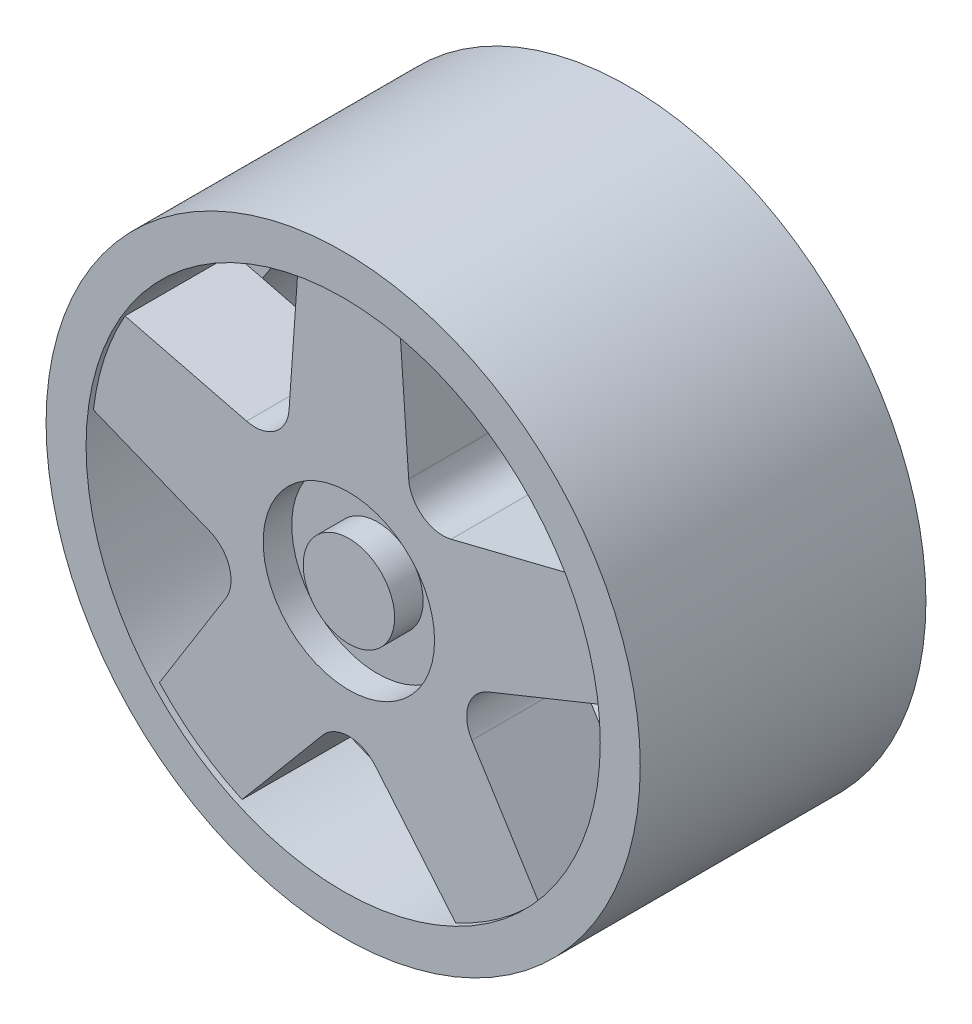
SolidWorks part; units mm, degrees
ref_plane "Front Plane" through (0, 0, 0) normal (0, 0, 1) x (1, 0, 0)
ref_plane "Top Plane" through (0, 0, 0) normal (0, 1, 0) x (1, 0, 0)
ref_plane "Right Plane" through (0, 0, 0) normal (1, 0, 0) x (0, 0, -1)
sketch "Sketch1" plane through (0, 0, 0) normal (0, 0, 1) x (1, 0, 0)
  circle A0 centre (-63.6221, -6.2963) radius 33
  dimension "D1" = 66
extrude "Boss-Extrude1" add sketch "Sketch1" along normal blind 25
fillet "Fillet1" radius 10 1 edges at (-30.6221, -6.2963, 25)
fillet "Fillet2" radius 3 1 edges at (-30.6221, -6.2963, 0)
sketch "Sketch2" plane through (0, 0, 0) normal (0, 0, -1) x (-1, 0, 0)
  spline S2 degree 3 number of poles 107 (83.6221, -6.2963) -> (83.6221, -6.2963)
  spline S3 degree 3 number of poles 107 (83.6221, -6.2963) -> (83.6221, -6.2963)
  dimension "D1" = 10
extrude "Cut-Extrude1" cut sketch "Sketch2" against normal blind 15
sketch "Sketch3" plane through (0, 0, 15) normal (0, 0, -1) x (-1, 0, 0)
  circle A0 centre (63.6221, -6.2963) radius 5
  dimension "D1" = 10
extrude "Boss-Extrude2" add sketch "Sketch3" along normal blind 20
sketch "Sketch6" plane through (0, 0, 25) normal (0, 0, 1) x (1, 0, 0)
  circle A0 centre (-63.6221, -6.2963) radius 7.5
  dimension "D1" = 15
extrude "Cut-Extrude2" cut sketch "Sketch6" against normal blind 3
sketch "Sketch7" plane through (0, 0, 22) normal (0, 0, 1) x (1, 0, 0)
  circle A0 centre (-63.6221, -6.2963) radius 4
  dimension "D1" = 8
extrude "Boss-Extrude3" add sketch "Sketch7" along normal blind 3
sketch "Sketch8" plane through (0, 0, 25) normal (0, 0, 1) x (1, 0, 0)
  circle A0 centre (-63.6221, -6.2963) radius 22.5
  dimension "D1" = 45
extrude "Cut-Extrude3" cut sketch "Sketch8" against normal blind 0.5
sketch "Sketch9" plane through (0, 0, 24.5) normal (0, 0, 1) x (1, 0, 0)
  line L0 (-63.6221, -6.2963) -> (-63.6221, -36.2963) construction
  line L1 (-72.9681, -26.7634) -> (-65.9202, -18.364)
  line L2 (-61.3239, -18.364) -> (-54.276, -26.7634)
  circle A0 centre (-63.6221, -6.2963) radius 22.5 construction
  arc A1 (-72.9681, -26.7634) -> (-54.276, -26.7634) centre (-63.6221, -6.2963) ccw
  arc A2 (-65.9202, -18.364) -> (-61.3239, -18.364) centre (-63.6221, -20.2924) cw
  spline S0 degree 3 poles (-34.0124, -12.186) (-33.4269, -6.2963) (-34.0124, -0.4066) (-35.7253, 5.2589) (-38.5202, 10.4762) (-42.2708, 15.0549) (-46.8495, 18.8056) (-52.0669, 21.6004) (-57.7323, 23.3134) (-63.6221, 23.8989) (-69.5118, 23.3134) (-75.1772, 21.6004) (-80.3946, 18.8056) (-84.9733, 15.0549) (-88.7239, 10.4762) (-91.5188, 5.2589) (-93.2317, -0.4066) (-93.8172, -6.2963) (-93.2317, -12.186) (-91.5188, -17.8515) (-88.7239, -23.0688) (-84.9733, -27.6475) (-80.3946, -31.3981) (-75.1772, -34.193) (-69.5118, -35.9059) (-63.6221, -36.4915) (-57.7323, -35.9059) (-52.0669, -34.193) (-46.8495, -31.3981) (-42.2708, -27.6475) (-38.5202, -23.0688) (-35.7253, -17.8515) (-34.0124, -12.186) (-33.4269, -6.2963) (-34.0124, -0.4066) knots -0.09375 -0.0625 -0.03125 0 0.03125 0.0625 0.09375 0.125 0.15625 0.1875 0.21875 0.25 0.28125 0.3125 0.34375 0.375 0.40625 0.4375 0.46875 0.5 0.53125 0.5625 0.59375 0.625 0.65625 0.6875 0.71875 0.75 0.78125 0.8125 0.84375 0.875 0.90625 0.9375 0.96875 1 1.03125 1.0625 1.09375 only from (-33.6221, -6.2963) to (-33.6221, -6.2963) construction
  point P9 (-63.6221, -15.6252)
  dimension "D3" = 3
  dimension "D1" = 40
  dimension "D2" = 40
extrude "Cut-Extrude4" cut sketch "Sketch9" against normal up to surface (9.5 mm away)
pattern_circular "CirPattern1" count 5 every 72 about axis through (-63.6221, -6.2963, 0) along (0, 0, 1) of "Cut-Extrude4"
sketch "Sketch10" plane through (0, 0, -5) normal (0, 0, -1) x (-1, 0, 0)
  circle A0 centre (63.6221, -6.2963) radius 2.5
extrude "Cut-Extrude5" cut sketch "Sketch10" against normal blind 20
sketch "Sketch11" plane through (0, 0, 25) normal (0, 0, 1) x (1, 0, 0)
  circle A0 centre (-63.6221, -6.2963) radius 26
  circle A1 centre (-63.6221, -6.2963) radius 33
  dimension "D1" = 52
extrude "Cut-Extrude6" cut sketch "Sketch11" against normal up to surface (25 mm away)
